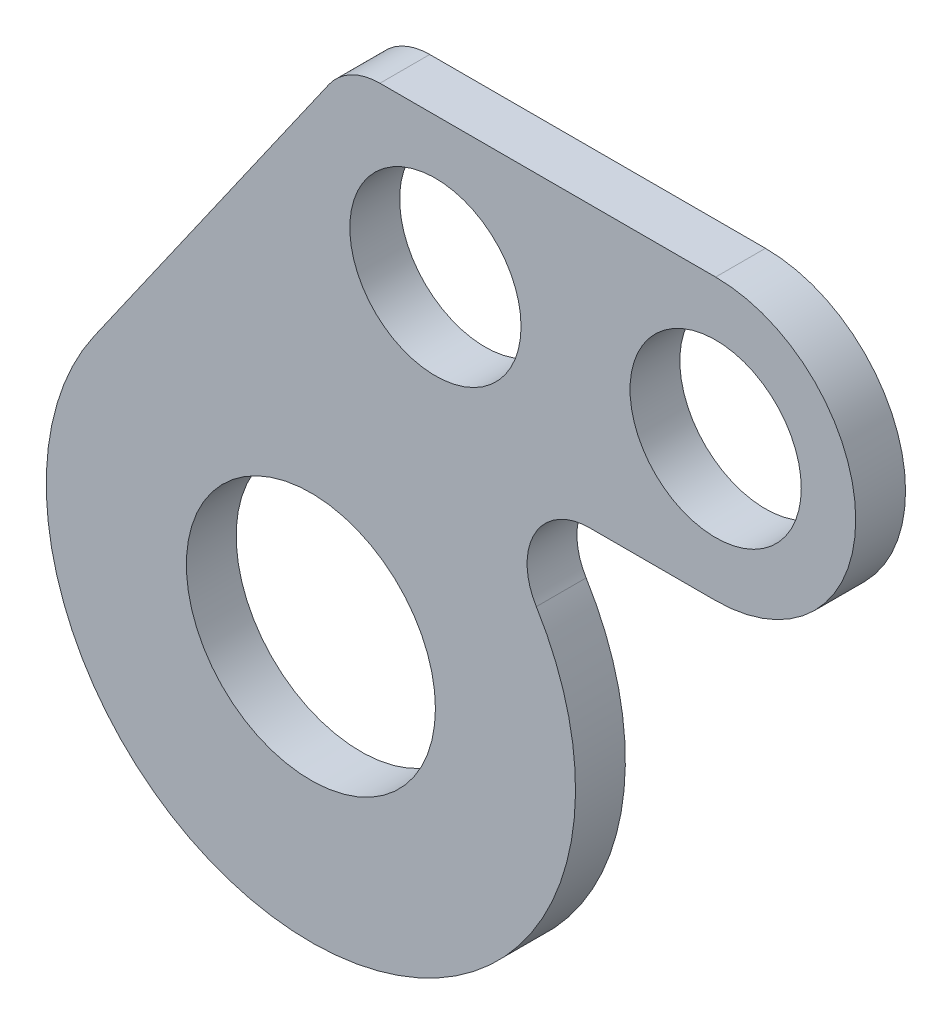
SolidWorks part; units mm, degrees
ref_plane "正面" through (0, 0, 0) normal (0, 0, 1) x (1, 0, 0)
ref_plane "平面" through (0, 0, 0) normal (0, 1, 0) x (1, 0, 0)
ref_plane "右側面" through (0, 0, 0) normal (1, 0, 0) x (0, 0, -1)
sketch "ｽｹｯﾁ1" plane through (0, 0, 0) normal (0, 0, 1) x (1, 0, 0)
  line L0 (13, 12) -> (13, -8.3072) construction
  line L1 (13, 12) -> (-25.7592, 12) construction
  line L2 (13, 16.5) -> (1.1768, 16.5)
  line L3 (1.1768, 16.5) -> (-6.9628, 4.8754)
  line L4 (13, 7.5) -> (4, 7.5)
  circle A0 centre (0, 0) radius 8.5
  circle A1 centre (13, 12) radius 4.5
  point P9 (4, 7.5)
  dimension "D1" = 17
  dimension "D3" = 9
  dimension "D2" = 12
  dimension "D4" = 13
  dimension "D5" = 125
extrude "ﾎﾞｽ - 押し出し1" add sketch "ｽｹｯﾁ1" along normal blind 1.6 contours A0 | A1 L2 L3 A0 L4 | A1
fillet "ﾌｨﾚｯﾄ1" radius 2 2 edges at (4, 7.5, 0.8) (1.1768, 16.5, 0.8)
sketch "ｽｹｯﾁ2" plane through (0, 0, 1.6) normal (0, 0, 1) x (1, 0, 0)
  circle A0 centre (0, 0) radius 4
  circle A1 centre (13, 12) radius 2.75
  circle A2 centre (4, 12) radius 2.75
  point P8 (0, 0)
  point P9 (0, 0)
  dimension "D1" = 8
  dimension "D2" = 5.5
  dimension "D3" = 9
extrude "ｶｯﾄ - 押し出し1" cut sketch "ｽｹｯﾁ2" against normal blind 1.6
